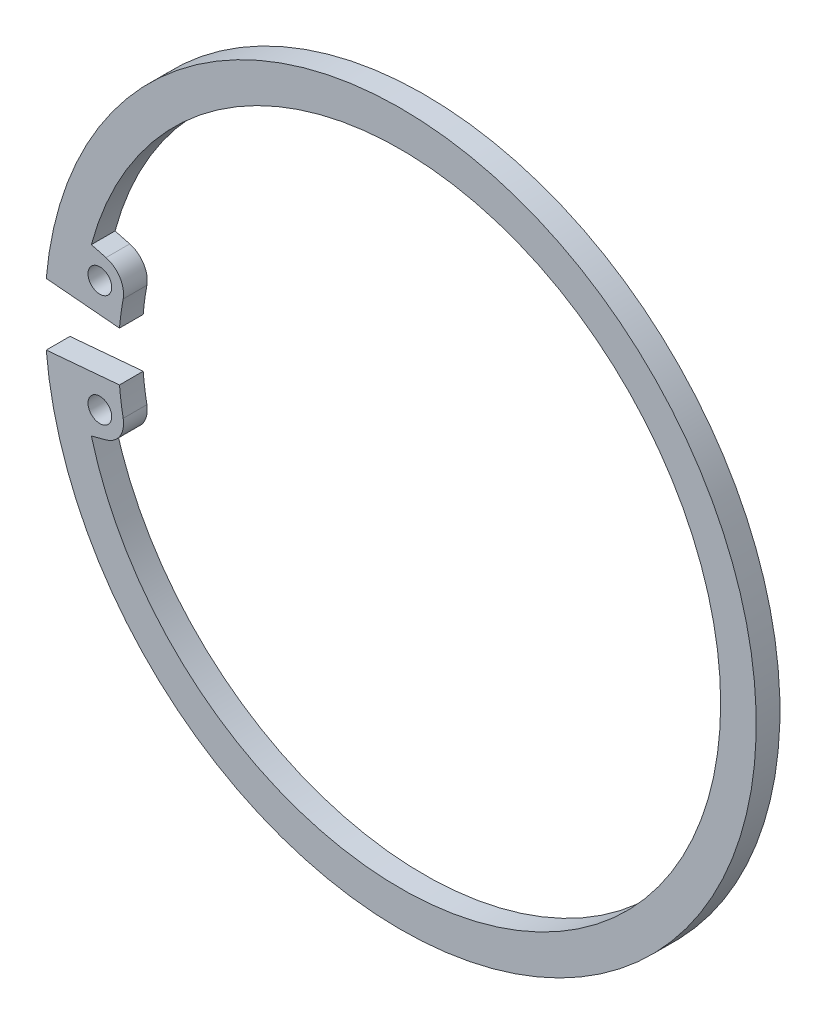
SolidWorks part; units mm, degrees
ref_plane "Face" through (0, 0, 0) normal (0, 0, 1) x (1, 0, 0)
ref_plane "Dessus" through (0, 0, 0) normal (0, 1, 0) x (1, 0, 0)
ref_plane "Droite" through (0, 0, 0) normal (1, 0, 0) x (0, 0, -1)
sketch "Esquisse1" plane through (0, 0, 0) normal (0, 0, 1) x (1, 0, 0)
  line L0 (0, 67.8704) -> (0, -77.674) construction
  line L1 (-75.2231, 0) -> (71.8296, 0) construction
  line L2 (0, 0) -> (-19.6508, 1.7192) construction
  line L3 (0, 0) -> (-17.8953, -4.795) construction
  line L4 (0, 0) -> (-18.186, 4.8729) construction
  line L5 (-13.04, 3.4941) -> (-12.4229, 3.3287)
  line L6 (-14.9429, 1.3073) -> (-11.8547, 1.0372)
  line L7 (-12.4229, -3.3287) -> (-13.04, -3.4941)
  line L9 (-14.9429, -1.3073) -> (-11.8547, -1.0372)
  arc A0 (-13.04, 3.4941) -> (-13.04, -3.4941) centre (0, 0) cw
  arc A1 (-14.4889, -3.8823) -> (-14.9429, 1.3073) centre (0, 0) ccw
  arc A2 (-11.6987, 2.1796) -> (-11.8547, 1.0372) centre (0, 0) ccw
  arc A3 (-11.6987, 2.1796) -> (-12.4229, 3.3287) centre (-12.6818, 2.3628) ccw
  circle A4 centre (-12.6818, 2.3628) radius 0.5
  circle A8 centre (-12.6818, -2.3628) radius 0.5
  arc A9 (-11.6987, -2.1796) -> (-12.4229, -3.3287) centre (-12.6818, -2.3628) cw
  arc A10 (-11.6987, -2.1796) -> (-11.8547, -1.0372) centre (0, 0) cw
  arc A11 (-14.9429, -1.3073) -> (-14.4889, -3.8823) centre (0, 0) ccw
  point P17 (-11.4945, 3.0799)
  dimension "D2" = 30
  dimension "D5" = 23.8
  dimension "D7" = 1
  dimension "D8" = 1
  dimension "D3" = 5
  dimension "D6" = 15
extrude "Base-Extrusion" add sketch "Esquisse1" along normal blind 1
